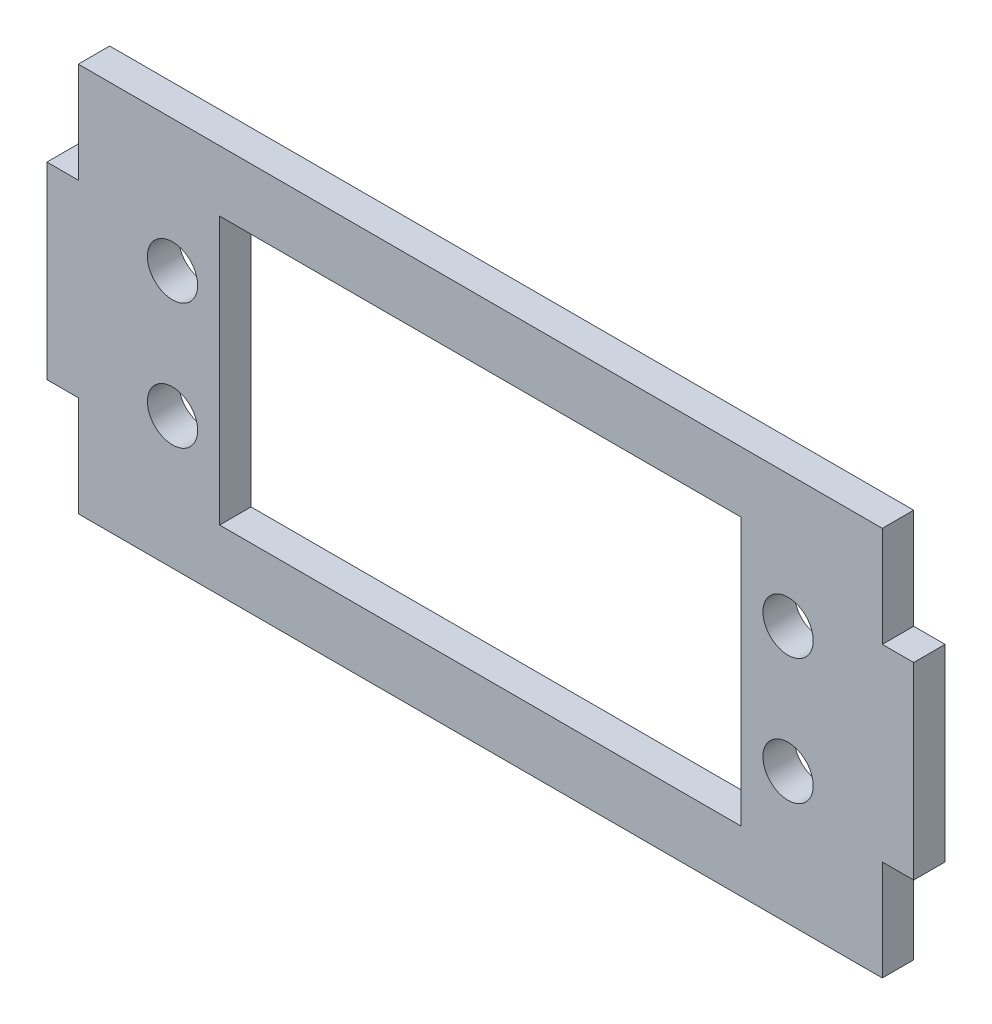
SolidWorks part; units mm, degrees
ref_plane "Front Plane" through (0, 0, 0) normal (0, 0, 1) x (1, 0, 0)
ref_plane "Top Plane" through (0, 0, 0) normal (0, 1, 0) x (1, 0, 0)
ref_plane "Right Plane" through (0, 0, 0) normal (1, 0, 0) x (0, 0, -1)
sketch "Sketch1" plane through (0, 0, 0) normal (0, 0, 1) x (1, 0, 0)
  line L0 (42, 40) -> (42, -40) construction
  line L1 (-22, 15.5) -> (42, 15.5)
  line L2 (-22, 15.5) -> (-22, 7.5)
  line L3 (-22, -15.5) -> (42, -15.5)
  line L4 (42, 15.5) -> (42, 7.5)
  line L6 (-17, 9) -> (-17, 6.5) construction
  line L7 (-10, 9.5) -> (-16.5, 9.5) construction
  line L8 (-10, -9.5) -> (-16.5, -9.5) construction
  line L9 (10, 15.5) -> (10, -15.5) construction
  line L10 (-22, 7.5) -> (-24.5, 7.5)
  line L12 (-22, -7.5) -> (-24.5, -7.5)
  line L13 (-24.5, 7.5) -> (-24.5, -7.5)
  line L14 (44.5, 7.5) -> (44.5, -7.5)
  line L15 (42, -7.5) -> (44.5, -7.5)
  line L17 (42, 7.5) -> (44.5, 7.5)
  line L18 (42, -7.5) -> (42, -15.5)
  line L19 (-22, -7.5) -> (-22, -15.5)
  line L20 (-10.3491, 10.2491) -> (30.3491, 10.2491) construction
  line L21 (-10.7491, 10.6491) -> (30.7491, 10.6491)
  line L22 (-10.7491, 10.6491) -> (-10.7491, -10.6491)
  line L23 (-10.7491, -10.6491) -> (30.7491, -10.6491)
  line L24 (30.7491, 10.6491) -> (30.7491, -10.6491)
  line L25 (-10.3491, -10.2491) -> (-10.3491, 10.2491) construction
  line L26 (30.3491, -10.2491) -> (-10.3491, -10.2491) construction
  line L27 (30.3491, 10.2491) -> (30.3491, -10.2491) construction
  dimension "D1" = 5
  dimension "D2" = 6
  dimension "D3" = 6
  dimension "D4" = 8
  dimension "D5" = 8
  dimension "D6" = 2.5
  dimension "D7" = 0.4
  dimension "D8" = 0.4
  dimension "D9" = 0.4
  dimension "D10" = 0.4
extrude "Boss-Extrude1" add sketch "Sketch1" along normal blind 2.5
sketch "Sketch2" plane through (0, 0, 0) normal (0, 0, -1) x (-1, 0, 0)
  circle A0 centre (14.5, 5) radius 2
  circle A1 centre (14.5, -5) radius 2
  circle A2 centre (-34.5, -5) radius 2
  circle A3 centre (-34.5, 5) radius 2
extrude "Cut-Extrude1" cut sketch "Sketch2" against normal blind 10
